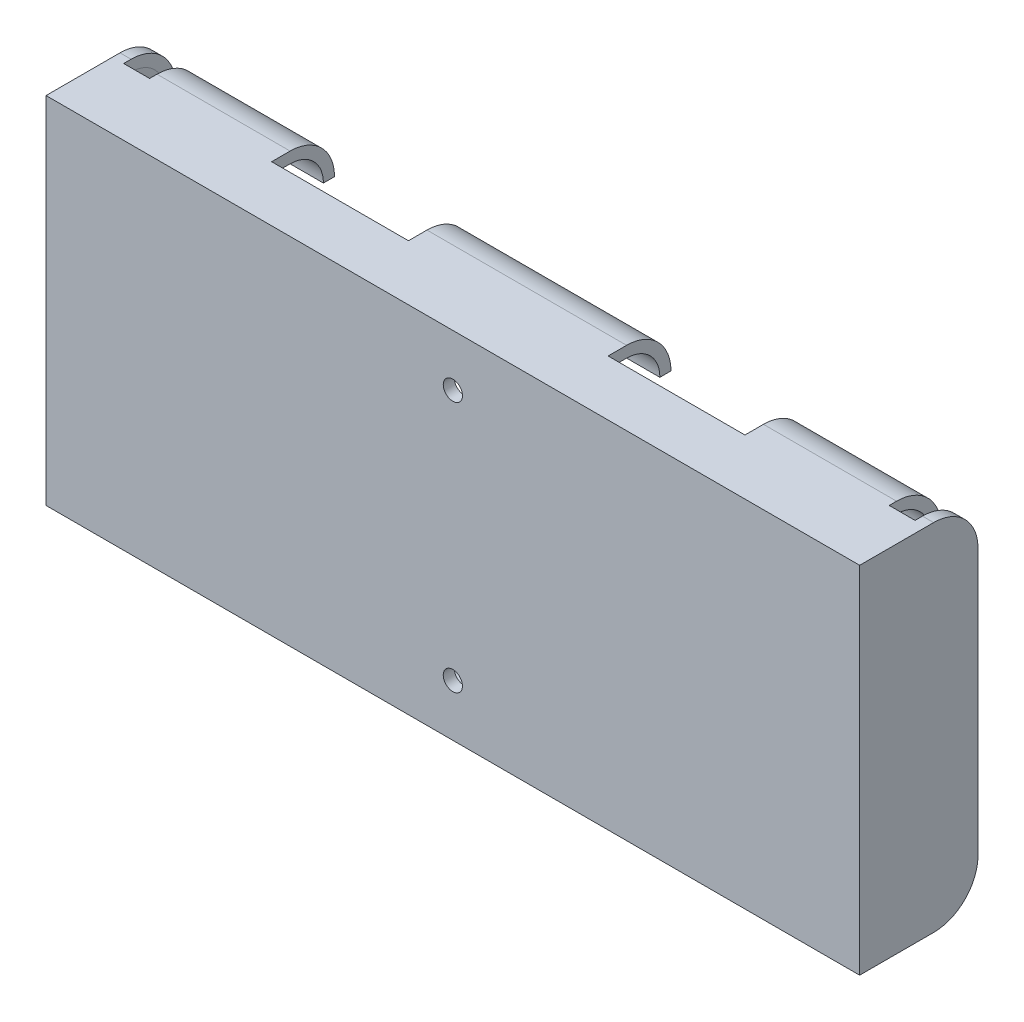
SolidWorks part; units mm, degrees
ref_plane "Face" through (0, 0, 0) normal (0, 0, 1) x (1, 0, 0)
ref_plane "Dessus" through (0, 0, 0) normal (0, 1, 0) x (1, 0, 0)
ref_plane "Droite" through (0, 0, 0) normal (1, 0, 0) x (0, 0, -1)
sketch "Esquisse1" plane through (0, 0, 0) normal (0, 0, 1) x (1, 0, 0)
  line L0 (-28.25, 36.4313) -> (-28.25, -47.0804) construction
  line L1 (81.7453, 38.4313) -> (81.7453, -45.0804) construction
  line L2 (9.824, -13.75) -> (95.8579, -13.75) construction
  line L5 (-28.25, 34.25) -> (81.75, 34.25)
  line L6 (-28.25, 34.25) -> (-28.2547, -13.75)
  line L7 (-28.2547, -13.75) -> (81.7453, -13.75)
  line L8 (81.75, 34.25) -> (81.7453, -13.75)
  dimension "D2" = 110
  dimension "D3" = 48
extrude "Base-Extrusion" add sketch "Esquisse1" against normal blind 16
fillet "Congé1" radius 6 2 edges at (26.75, 34.25, -16) (26.7453, -13.75, -16)
shell "Coque1" thickness 1.5
sketch "Esquisse3" plane through (0, 34.25, 0) normal (0, 1, 0) x (-1, 0, 0)
  line L0 (39.6847, -9) -> (-24.3611, -9) construction
  line L1 (26.75, -2.27) -> (26.75, -22.4823) construction
  line L2 (-26.7453, 0) -> (-26.7453, -22.4823) construction
  line L3 (12.4989, -7.5) -> (-13.5693, -7.5) construction
  line L4 (28.2547, 0) -> (-81.7453, 0) construction
  line L5 (39.6847, 0) -> (-4.2265, 0) construction
  line L6 (-76.7405, -9) -> (-76.7405, -19.2081)
  line L7 (-80.2405, -19.2081) -> (-76.7405, -19.2081)
  line L8 (-80.2405, -9) -> (-80.2405, -19.2081)
  line L9 (26.75, -9) -> (23.25, -9)
  line L10 (26.75, -9) -> (26.75, -19.2081)
  line L11 (26.75, -19.2081) -> (23.25, -19.2081)
  line L12 (23.25, -9) -> (23.25, -19.2081)
  line L13 (5.25, -7.5) -> (-13.25, -7.5)
  line L14 (5.25, -7.5) -> (5.25, -18.3265)
  line L15 (5.25, -18.3265) -> (-13.25, -18.3265)
  line L16 (-13.25, -7.5) -> (-13.25, -18.3265)
  line L17 (-80.2405, -9) -> (-76.7405, -9)
  line L18 (-40.2405, -7.5) -> (-40.2405, -18.3265)
  line L19 (-58.7405, -18.3265) -> (-40.2405, -18.3265)
  line L20 (28.2547, 9.3212) -> (28.2547, -36.0587) construction
  line L21 (-58.7405, -7.5) -> (-58.7405, -18.3265)
  line L22 (-58.7405, -7.5) -> (-40.2405, -7.5)
  dimension "D1" = 1.5047
  dimension "D2" = 3.5
  dimension "D3" = 18
  dimension "D4" = 9
  dimension "D5" = 18.5
  dimension "D6" = 7.5
extrude "Enlèv. mat.-Extru.2" cut sketch "Esquisse3" against normal through all
sketch "Esquisse5" plane through (-41.166, -21.1238, -1.5) normal (0, 0, -1) x (-1, 0, 0)
  line L0 (-121.4137, 31.3738) -> (0, 31.3738) construction
  line L2 (-12.916, 73.6198) -> (-12.916, -15.0025) construction
  line L3 (-67.916, 73.6198) -> (-67.916, 39.2561) construction
  line L5 (-121.4119, 13.3738) -> (-121.4154, 49.3738) construction
  line L6 (0, 48.3738) -> (-78.5163, 48.3738) construction
  circle A0 centre (-67.916, 48.3738) radius 1.3
  circle A1 centre (-67.916, 14.3738) radius 1.3
  dimension "D1" = 17
  dimension "D2" = 55
extrude "Enlèv. mat.-Extru.4" cut sketch "Esquisse5" against normal through all
